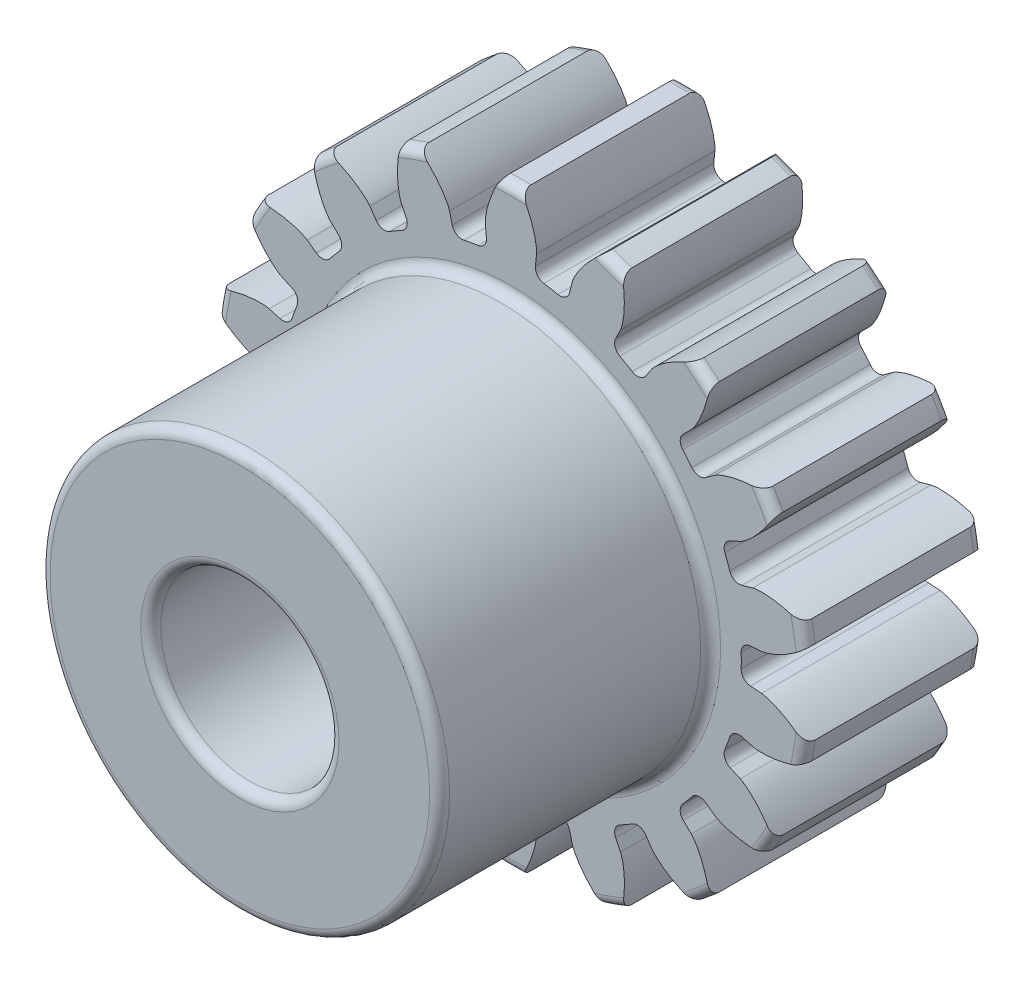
SolidWorks part; units mm, degrees
ref_plane "Front Plane" through (0, 0, 0) normal (0, 0, 1) x (1, 0, 0)
ref_plane "Top Plane" through (0, 0, 0) normal (0, 1, 0) x (1, 0, 0)
ref_plane "Right Plane" through (0, 0, 0) normal (1, 0, 0) x (0, 0, -1)
sketch "Sketch1" plane through (0, 0, 0) normal (0, 0, 1) x (1, 0, 0)
  line L0 (0, 0) -> (0, 4.7625) construction
  line L1 (-1.5306, 5.3196) -> (1.5306, 4.2054) construction
  circle A0 centre (0, 0) radius 4.101 construction
  circle A1 centre (0, 0) radius 5.2917 construction
  circle A2 centre (0, 0) radius 4.7625 construction
  circle A3 centre (0, 0) radius 4.4753 construction
  circle A4 centre (0, 0) radius 1.5875 construction
  circle A5 centre (0, 0) radius 3.556 construction
  point P8 (609.6, 0)
  point P13 (228.6, 0)
sketch "Sketch2" plane through (0, 0, 0) normal (1, 0, 0) x (0, 0, -1)
  line L0 (-4.0005, 0) -> (4.0005, 0) construction
  line L1 (-4.0005, 5.2917) -> (4.0005, 5.2917) construction
  point P2 (0, 5.2917)
  point P4 (0.8255, 0)
  point P6 (0.8255, 5.2917)
  dimension "Overall Width" = 8.001
  dimension "Hub Width" = 4.826
  dimension "Face Width" = 3.175
sketch "Sketch3" plane through (0, 0, 0) normal (0, 0, 1) x (1, 0, 0)
  circle A0 centre (0, 0) radius 5.2917
  circle A1 centre (0, 0) radius 5.2917 construction
extrude "Boss-Extrude1" add sketch "Sketch3" against normal up to vertex (4.0005 mm away) and the other way up to vertex (4.0005 mm away)
sketch "Sketch5" plane through (0, 0, 0) normal (1, 0, 0) x (0, 0, -1)
  line L1 (-4.0005, 5.2917) -> (0.8255, 5.2917)
  line L2 (-4.0005, 5.2917) -> (-4.0005, 3.556)
  line L3 (-4.0005, 3.556) -> (0.8255, 3.556)
  line L4 (0.8255, 5.2917) -> (0.8255, 3.556)
  line L11 (4.0005, 1.5875) -> (-4.0005, 1.5875)
  line L12 (4.0005, 1.5875) -> (4.0005, 0)
  line L13 (4.0005, 0) -> (-4.0005, 0)
  line L14 (-4.0005, 1.5875) -> (-4.0005, 0)
  point P5 (0, 1.5875)
  point P12 (0, 3.556)
revolve "Cut-Revolve1" cut sketch "Sketch5" angle 360 about L0
fillet "Fillet2" radius 0.1775 6 edges at (5.2917, 0, -4.0005) (1.5875, 0, -4.0005) (1.5875, 0, 4.0005) (3.556, 0, -0.8255) (5.2917, 0, -0.8255) (3.556, 0, 4.0005)
sketch "Sketch4" plane through (0, 0, 0) normal (0, 0, 1) x (1, 0, 0)
  line L0 (0, 0) -> (4.0903, 0.2965) construction
  line L2 (0, 0) -> (4.0903, -0.2965) construction
  line L4 (4.0903, 0.2965) -> (4.4636, 0.3236)
  line L5 (4.4636, -0.3236) -> (4.0903, -0.2965)
  arc A0 (4.0903, 0.2965) -> (4.0903, -0.2965) centre (0, 0) cw
  arc A3 (5.2396, 0.7408) -> (5.2396, -0.7408) centre (0, 0) cw
  circle A4 centre (0, 0) radius 5.2917 construction
  spline S0 degree 4 poles (4.4636, 0.3236) (4.4649, 0.3237) (4.4686, 0.324) (4.4755, 0.325) (4.4868, 0.3268) (4.5011, 0.3295) (4.5195, 0.3335) (4.5411, 0.339) (4.5648, 0.3456) (4.5904, 0.3536) (4.6158, 0.3621) (4.641, 0.3713) (4.666, 0.381) (4.6961, 0.3934) (4.732, 0.4091) (4.7737, 0.4287) (4.8205, 0.4525) (4.8677, 0.4784) (4.9138, 0.5051) (4.9599, 0.5336) (5.0042, 0.5623) (5.0496, 0.5936) (5.0913, 0.6232) (5.1373, 0.6581) (5.1743, 0.6867) (5.2224, 0.7262) (5.2506, 0.75) (5.2834, 0.7786) (5.2978, 0.7915) (5.3067, 0.7995) knots 0 0 0 0 0 0.005377 0.015084 0.028532 0.04661 0.064855 0.092111 0.119476 0.146842 0.174209 0.201575 0.228941 0.256307 0.307035 0.361767 0.4165 0.471232 0.525964 0.580697 0.635429 0.690161 0.744894 0.799626 0.854358 0.909091 0.954545 1 1 1 1 1 construction
  spline S1 degree 4 poles (4.4636, 0.3236) (4.4649, 0.3237) (4.4686, 0.324) (4.4755, 0.325) (4.4868, 0.3268) (4.5011, 0.3295) (4.5195, 0.3335) (4.5411, 0.339) (4.5648, 0.3456) (4.5904, 0.3536) (4.6158, 0.3621) (4.641, 0.3713) (4.666, 0.381) (4.6961, 0.3934) (4.732, 0.4091) (4.7737, 0.4287) (4.8205, 0.4525) (4.8677, 0.4784) (4.9138, 0.5051) (4.9599, 0.5336) (5.0042, 0.5623) (5.0496, 0.5936) (5.0913, 0.6232) (5.1373, 0.6581) (5.1743, 0.6867) (5.212, 0.7176) (5.2303, 0.7329) (5.2396, 0.7408) knots 0 0 0 0 0 0.005377 0.015084 0.028532 0.04661 0.064855 0.092111 0.119476 0.146842 0.174209 0.201575 0.228941 0.256307 0.307035 0.361767 0.4165 0.471232 0.525964 0.580697 0.635429 0.690161 0.744894 0.799626 0.854358 0.909091 0.909091 0.909091 0.909091 0.909091
  spline S2 degree 4 poles (4.4636, -0.3236) (4.4649, -0.3237) (4.4686, -0.324) (4.4755, -0.325) (4.4868, -0.3268) (4.5011, -0.3295) (4.5195, -0.3335) (4.5411, -0.339) (4.5648, -0.3456) (4.5904, -0.3536) (4.6158, -0.3621) (4.641, -0.3713) (4.666, -0.381) (4.6961, -0.3934) (4.732, -0.4091) (4.7737, -0.4287) (4.8205, -0.4525) (4.8677, -0.4784) (4.9138, -0.5051) (4.9599, -0.5336) (5.0042, -0.5623) (5.0496, -0.5936) (5.0913, -0.6232) (5.1373, -0.6581) (5.1743, -0.6867) (5.2224, -0.7262) (5.2506, -0.75) (5.2834, -0.7786) (5.2978, -0.7915) (5.3067, -0.7995) knots 0 0 0 0 0 0.005377 0.015084 0.028532 0.04661 0.064855 0.092111 0.119476 0.146842 0.174209 0.201575 0.228941 0.256307 0.307035 0.361767 0.4165 0.471232 0.525964 0.580697 0.635429 0.690161 0.744894 0.799626 0.854358 0.909091 0.954545 1 1 1 1 1 construction
  spline S3 degree 4 poles (4.4636, -0.3236) (4.4649, -0.3237) (4.4686, -0.324) (4.4755, -0.325) (4.4868, -0.3268) (4.5011, -0.3295) (4.5195, -0.3335) (4.5411, -0.339) (4.5648, -0.3456) (4.5904, -0.3536) (4.6158, -0.3621) (4.641, -0.3713) (4.666, -0.381) (4.6961, -0.3934) (4.732, -0.4091) (4.7737, -0.4287) (4.8205, -0.4525) (4.8677, -0.4784) (4.9138, -0.5051) (4.9599, -0.5336) (5.0042, -0.5623) (5.0496, -0.5936) (5.0913, -0.6232) (5.1373, -0.6581) (5.1743, -0.6867) (5.212, -0.7176) (5.2303, -0.7329) (5.2396, -0.7408) knots 0 0 0 0 0 0.005377 0.015084 0.028532 0.04661 0.064855 0.092111 0.119476 0.146842 0.174209 0.201575 0.228941 0.256307 0.307035 0.361767 0.4165 0.471232 0.525964 0.580697 0.635429 0.690161 0.744894 0.799626 0.854358 0.909091 0.909091 0.909091 0.909091 0.909091
extrude "Cut-Extrude1" cut sketch "Sketch4" against normal through all both and the other way through all
fillet "Fillet1" radius 0.1775 2 edges at (4.0903, -0.2965, -2.413) (4.0903, 0.2965, -2.413)
pattern_circular "CirPattern1" count 18 over 360 about axis through (0, 0, 4.0005) along (0, 0, -1) of "Cut-Extrude1", "Fillet1"
equation "\"Root Diameter@Sketch1\"=\"Root Diameter\""
equation "\"OD | Outside Diameter@Sketch1\"=\"Outside Diameter\""
equation "\"D1@CirPattern1\"=\"Number of Teeth\""
equation "\"Diametral Pitch\"= 48"
equation "\"Number of Teeth\"= 18"
equation "\"Pressure Angle\"=20"
equation "\"Pitch Diameter\"= \"Number of Teeth\" / \"Diametral Pitch\""
equation "\"Base Diameter\"= \"Pitch Diameter\" * cos ( \"Pressure Angle\" )"
equation "\"Outside Diameter\"= ( \"Number of Teeth\" + 2 ) / \"Diametral Pitch\""
equation "\"Dedendum\"= 1.25 / \"Diametral Pitch\""
equation "\"Root Diameter\"= \"Pitch Diameter\" - ( 2 * \"Dedendum\" )"
equation "\"Pitch Angle\"= 360deg / \"Number of Teeth\""
equation "\"Alpha\"= sqr ( \"Pitch Diameter\" ^ 2 - \"Base Diameter\" ^ 2 ) / \"Base Diameter\" * 180 / PI - \"Pressure Angle\""
equation "\"Beta\"= ( \"Pitch Angle\" / 4 - \"Alpha\" )"
equation "\"Phi\"= sqr ( ( \"Outside Diameter\" / 2 ) ^ 2 - ( \"Base Diameter\" / 2 ) ^ 2 ) / ( \"Base Diameter\" / 2 )"
equation "\"Addendum\"= 1 / \"Diametral Pitch\""
equation "\"WorkingDepth\"= 2 / \"Diametral Pitch\""
equation "\"WholeDepth\"= 2.25 / \"Diametral Pitch\""
equation "\"Clearance\"= 0.25 / \"Diametral Pitch\""
equation "\"ToothThickness\"= ( pi * 2 ) / \"Diametral Pitch\""
equation "\"CircularPitch\"= pi / \"Diametral Pitch\""
equation "\"Number of Teeth@Sketch1\"=\"Number of Teeth\""
equation "\"Gear Pitch | Diametral Pitch@Sketch1\"=\"Diametral Pitch\""
equation "\"Pressure Angle@Sketch1\"=\"Pressure Angle\""
equation "\"Gear Pitch Diameter@Sketch1\"=\"Pitch Diameter\""
equation "\"Base Diameter@Sketch1\"=\"Base Diameter\""
equation "\"Fillet\"= \"Clearance\" * cos ( \"Pressure Angle\" ) * tan ( ( 90 + \"Pressure Angle\" ) / 2 )"
equation "\"D1@Fillet1\"=\"Fillet\""
equation "\"D1@Sketch4\"=if( \"Base Diameter\">\"Root Diameter\",\"Root Diameter\",\"Base Diameter\"-.00001)"
equation "\"D1@Fillet2\"=\"Fillet\""
